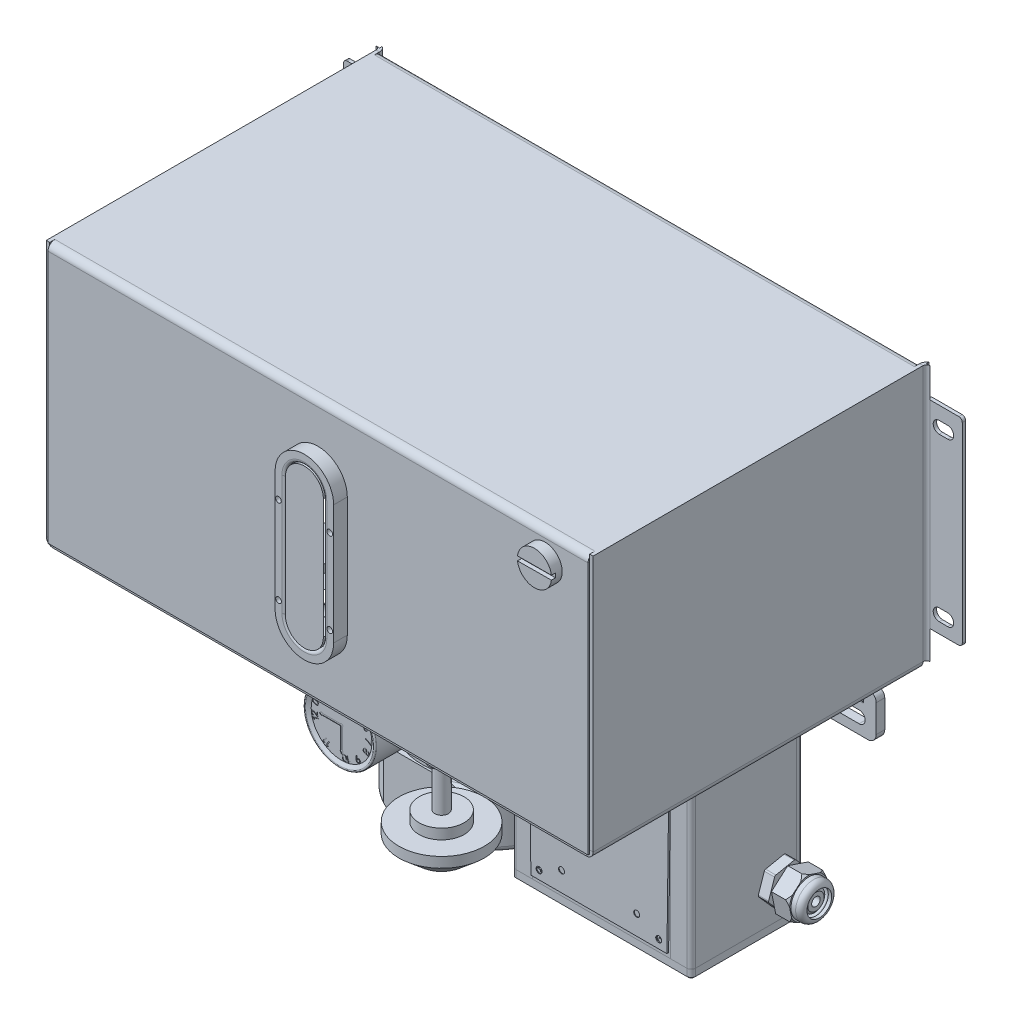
SolidWorks part; units mm, degrees
ref_plane "前视基准面" through (0, 0, 0) normal (0, 0, 1) x (1, 0, 0)
ref_plane "上视基准面" through (0, 0, 0) normal (0, 1, 0) x (1, 0, 0)
ref_plane "右视基准面" through (0, 0, 0) normal (1, 0, 0) x (0, 0, -1)
imported_body "8L铁油箱-1-surface1"
imported_body "8L铁油箱-1-surface2"
imported_body "装配体-1/控制壳（电控箱体）-1-surface1"
imported_body "装配体-1/控制壳（电控箱体）-1-surface2"
imported_body "装配体-1/电源控制板-1-surface1"
imported_body "装配体-1/上盖座（泵本体座）-2-surface1"
imported_body "装配体-1/上盖座（泵本体座）-2-surface2"
imported_body "装配体-1/电机马达-2-surface1"
imported_body "装配体-1/hexagon socket button head screws gb-2-surface1"
imported_body "装配体-1/控制壳盖板1（电控箱盖）-1-surface1"
imported_body "装配体-1/hexagon socket button head screws gb-4-surface1"
imported_body "装配体-1/hexagon socket button head screws gb-6-surface1"
imported_body "装配体-1/hexagon socket button head screws gb-6-surface2"
imported_body "装配体-1/hexagon socket button head screws gb-7-surface1"
imported_body "装配体-1/hexagon socket button head screws gb-8-surface1"
imported_body "装配体-1/hexagon socket button head screws gb-9-surface1"
imported_body "装配体-1/hexagon socket button head screws gb-10-surface1"
imported_body "装配体-1/电源接线座-1-surface1"
imported_body "装配体-1/电源接线座-1-surface2"
imported_body "装配体-1/电源接线座圆螺母-1-surface1"
imported_body "装配体-1/加油固定盖-1-surface1"
imported_body "装配体-1/加油旋转盖-2-surface1"
imported_body "装配体-1/加油旋转盖-2-surface2"
imported_body "装配体-1/加油旋转盖-2-surface3"
imported_body "装配体-1/加油旋转盖-2-surface4"
imported_body "装配体-1/加油旋转盖-2-surface5"
imported_body "装配体-1/cross recessed countersunk head screws gb1-10-surface1"
imported_body "装配体-1/cross recessed countersunk head screws gb1-13-surface1"
imported_body "装配体-1/cross recessed countersunk head screws gb1-13-surface2"
imported_body "装配体-1/cross recessed countersunk head screws gb2-3-surface1"
imported_body "装配体-1/控制面板-1-surface1"
imported_body "装配体-1/控制面板-1-surface2"
imported_body "装配体-1/控制面板-1-surface3"
imported_body "slotted cheese head screws with shoulder gb-2-surface1"
imported_body "压力表-1-surface1"
imported_body "压力表-1-surface2"
imported_body "压力表-1-surface3"
imported_body "压力表-1-surface4"
imported_body "压力表-1-surface5"
imported_body "压力表-1-surface6"
imported_body "压力表-1-surface7"
imported_body "零件1-1-surface1"
sketch "草图1" plane through (0, 0, 385.7389) normal (0, 0, 1) x (1, 0, 0)
  line L1 (69.5541, 10.4036) -> (-18.5034, 10.4036)
  line L2 (69.5541, 10.4036) -> (69.5541, 85.7158)
  line L3 (69.5541, 85.7158) -> (-18.5034, 85.7158)
  line L4 (-18.5034, 10.4036) -> (-18.5034, 85.7158)
surface "曲面-拉伸1" sketch "草图1" parameters "D1"=339
surface "曲面-剪裁1"
